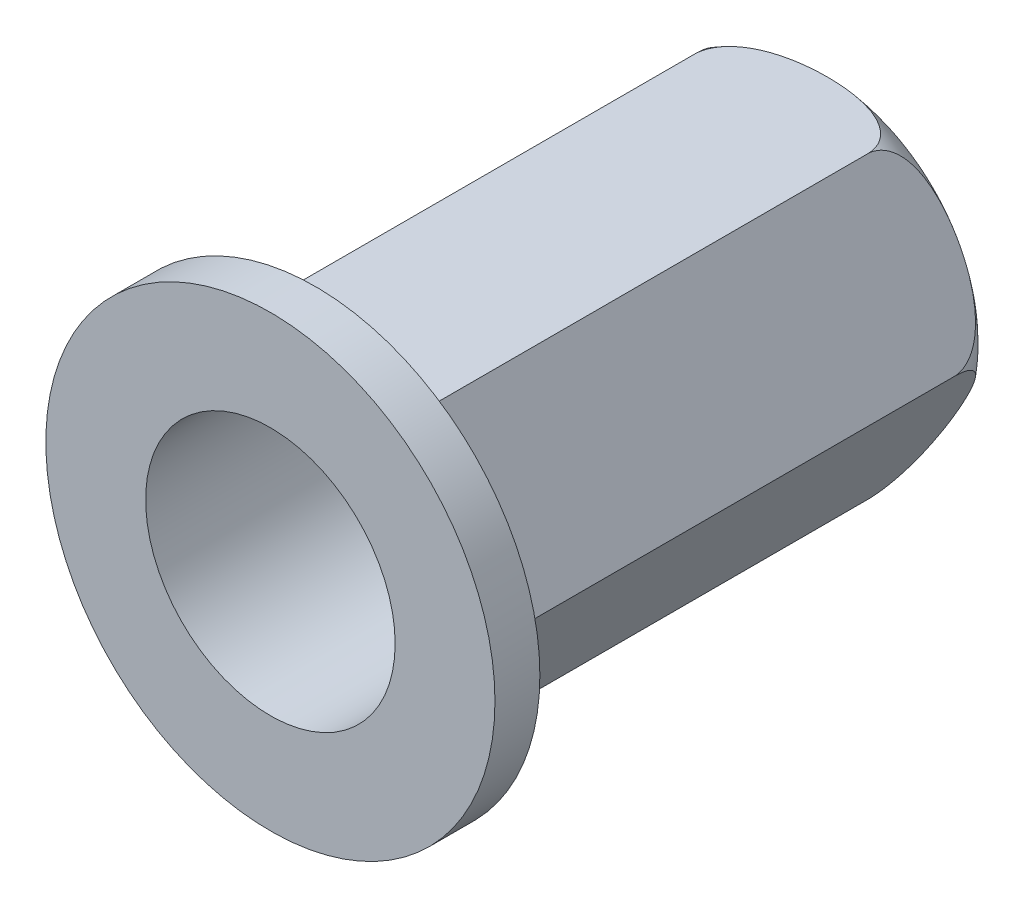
SolidWorks part; units mm, degrees
ref_plane "Front" through (0, 0, 0) normal (0, 0, 1) x (1, 0, 0)
ref_plane "Top" through (0, 0, 0) normal (0, 1, 0) x (1, 0, 0)
ref_plane "Right" through (0, 0, 0) normal (1, 0, 0) x (0, 0, -1)
sketch "Sketch3" plane through (0, 0, 0) normal (0, 0, 1) x (1, 0, 0)
  circle A0 centre (0, 0) radius 9
extrude "BaseHead" add sketch "Sketch3" against normal blind 1.8
sketch "Sketch4" plane through (2.8191, -1.6346, -1.8) normal (0, 0, -1) x (-1, 0, 0)
  line L1 (-0.645, 7.6346) -> (-4.1091, 1.6346)
  line L2 (-4.1091, 1.6346) -> (-0.645, -4.3654)
  line L3 (-0.645, -4.3654) -> (6.2832, -4.3654)
  line L4 (6.2832, -4.3654) -> (9.7473, 1.6346)
  line L5 (9.7473, 1.6346) -> (6.2832, 7.6346)
  line L6 (6.2832, 7.6346) -> (-0.645, 7.6346)
  circle A0 centre (2.8191, 1.6346) radius 6 construction
  circle A1 centre (2.8191, 1.6346) radius 6 construction
  circle A2 centre (2.8191, 1.6346) radius 9 construction
  dimension "s" = 12
extrude "BaseBody" add sketch "Sketch4" along normal blind 21
sketch "Sketch5" plane through (4.0795, 0.9752, 0) normal (0, 0, 1) x (1, 0, 0)
  circle A0 centre (-4.0795, -0.9752) radius 5
  circle A1 centre (-4.0795, -0.9752) radius 9 construction
extrude "Hole1" cut sketch "Sketch5" against normal blind 7.3
sketch "Sketch6" plane through (1.8124, 4.1988, -7.3) normal (0, 0, 1) x (1, 0, 0)
  circle A0 centre (-1.8124, -4.1988) radius 3.5
  circle A1 centre (-1.8124, -4.1988) radius 5 construction
extrude "Hole2" cut sketch "Sketch6" against normal through all
sketch "Sketch7" plane through (8.6603, 0, 20.3033) normal (0, 1, 0) x (-1, 0, 0)
  line L0 (8.6603, 2.4967) -> (8.6603, -3.5015) construction
  line L3 (15.5885, -43.1033) -> (12.1244, -43.1033) construction
  line L5 (15.5885, -43.1033) -> (15.5885, -22.1033) construction
  line L6 (15.5885, -43.1033) -> (13.2551, -43.1033)
  line L8 (15.5885, -43.1033) -> (15.5885, -40.77)
  arc A0 (13.2551, -43.1033) -> (15.5885, -40.77) centre (13.2551, -40.77) ccw
revolve "Cut-Revolve1" cut sketch "Sketch7" angle 360 about L0
fillet "Fillet1" radius 0.9 6 edges at (0, -6, -1.8) (-5.1962, -3, -1.8) (-5.1962, 3, -1.8) (0, 6, -1.8) (5.1962, 3, -1.8) (5.1962, -3, -1.8)
chamfer "Chamfer1" distance 0.4667 angle 45 1 edges at (3.5, 0, -22.8)
chamfer "Chamfer2" distance 1.5 angle 45 1 edges at (3.5, 0, -7.3)
sketch "Sketch9" plane through (0, 0, 0) normal (1, 0, 0) x (0, 0, -1)
  line L0 (-5.9053, 0) -> (27.963, 0) construction
  line L1 (22.0833, -3.5) -> (22.0833, -3)
  line L2 (22.0833, -3) -> (22.5833, -3)
  line L3 (22.5833, -3) -> (22.5833, -3.5)
  line L4 (22.5833, -3.5) -> (22.3333, -3.933)
  line L5 (22.3333, -3.933) -> (22.0833, -3.5)
  line L6 (22.3333, -3.5) -> (22.3333, 3.5) construction
revolve "Cut-Revolve10" [suppressed] cut sketch "Sketch9" angle 360 about L0
pattern_linear "LPattern10" [suppressed] count 25 spacing 0.6 along (0, 0, -1)
equation "\"D1@Chamfer1\" = \"D1@Sketch6\" / 15"
equation "\"D1@Chamfer2\" =  ( \"d1@Sketch5\" - \"D1@Sketch6\" )  / 2"
equation "\"r@Sketch7\" = \"D1@Chamfer1\" * 5"
equation "\"D1@Sketch9\" = (  \"D2@ThreadCosmetic1\" - \"D1@Sketch6\" )  / 2"
equation "\"D3@LPattern10\" = \"D1@Sketch9\" * 1.2 "
equation "\"D1@LPattern10\" =  (  \"l@BaseBody\" + \"k@BaseHead\" - \"l1@Hole1\" )  / \"D3@LPattern10\" - 1"
equation "\"D1@Fillet1\" = \"dk@Sketch3\" / 20"
equation "\"D2@Sketch9\" = \"D1@Sketch6\""
